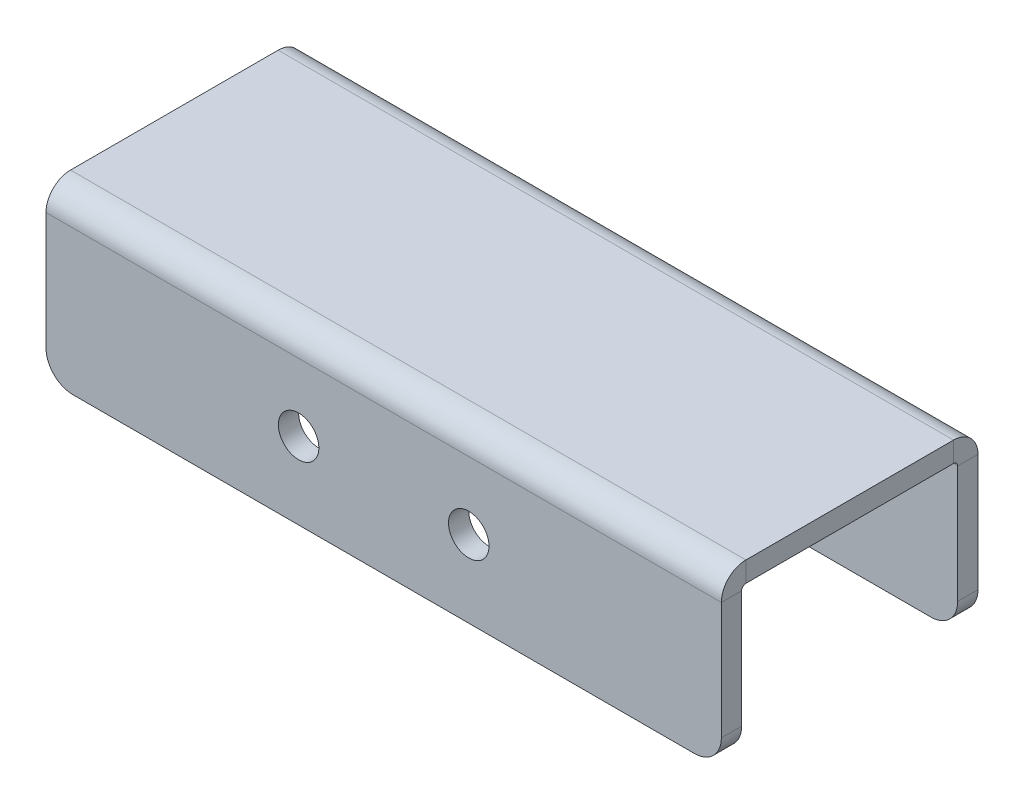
SolidWorks part; units mm, degrees
ref_plane "Front Plane" through (0, 0, 0) normal (0, 0, 1) x (1, 0, 0)
ref_plane "Top Plane" through (0, 0, 0) normal (0, 1, 0) x (1, 0, 0)
ref_plane "Right Plane" through (0, 0, 0) normal (1, 0, 0) x (0, 0, -1)
body saved out of another part "Stock-Piranha-h0400-4301-1"
flatten bends "Flatten-Bends1" thickness 4.7625 parameters "D1"=0
sketch "Sharp-Sketch1" plane through (0, 37.4347, 0) normal (0, 1, 0) x (1, 0, 0)
  line L0 (420.9678, -97.2612) -> (262.2178, -97.2612) construction
  line L1 (262.2178, -43.9728) -> (420.9678, -43.9728) construction
bend "RoundBend1" bend radius 1 bend angle 90 parameters "D5"=1
bend "RoundBend2" bend radius 1 bend angle 90 parameters "D5"=2
process bends "Process-Bends1" thickness 4.7625 parameters "D1"=0
sketch "Flat-Sketch1" plane through (0, 37.4347, 0) normal (0, 1, 0) x (1, 0, 0)
other "Move Face1" parameters "D1"=0.3969
sketch "Bend-Lines1" plane through (0, 0, 0) normal (0, 1, 0) x (1, 0, 0)
sketch "Bounding-Box1" plane through (0, 0, 0) normal (0, 1, 0) x (1, 0, 0)
sheet metal parameters "Sheet-Metal2" thickness 4.7625 parameters "D1"=1
flat pattern "Flat-Pattern2"
sketch "Bend-Lines2" plane through (0, 37.4347, 0) normal (0, 1, 0) x (1, 0, 0)
  line L0 (262.2178, -43.9728) -> (420.9678, -43.9728) construction
  line L1 (420.9678, -97.2612) -> (262.2178, -97.2612) construction
  line L2 (262.2178, -43.9728) -> (420.9678, -43.9728) construction
  line L3 (420.9678, -97.2612) -> (262.2178, -97.2612) construction
sketch3d "Bounding-Box2" [suppressed]
  line L0 (-158.75, -87.2133, 0) -> (0, -87.2134, 0) construction
  line L1 (-158.75, 38.4134, 0) -> (0, 38.4133, 0) construction
  line L2 (-158.75, -87.2133, 0) -> (-158.75, 38.4134, 0) construction
  line L3 (0, -87.2134, 0) -> (0, 38.4133, 0) construction
bend of the flat pattern "Flatten-<RoundBend1>1"
bend of the flat pattern "Flatten-<RoundBend2>1"
